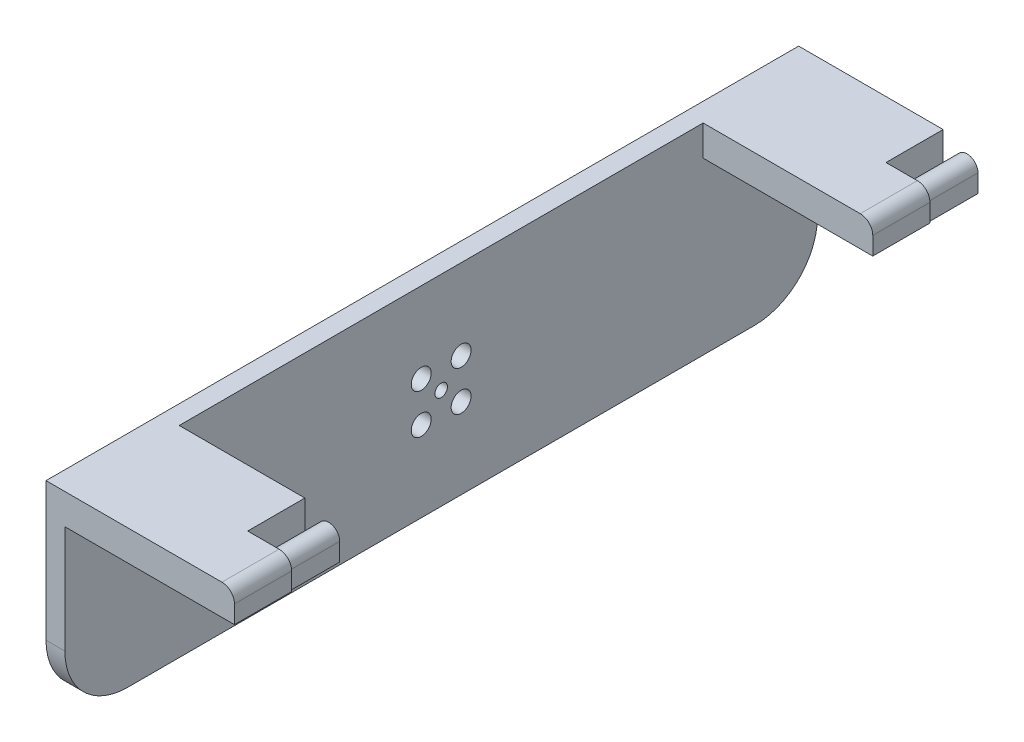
SolidWorks part; units mm, degrees
ref_plane "Front Plane" through (0, 0, 0) normal (0, 0, 1) x (1, 0, 0)
ref_plane "Top Plane" through (0, 0, 0) normal (0, 1, 0) x (1, 0, 0)
ref_plane "Right Plane" through (0, 0, 0) normal (1, 0, 0) x (0, 0, -1)
sketch "Sketch1" plane through (0, 0, 0) normal (0, 0, 1) x (1, 0, 0)
  line L2 (-1.75, 0) -> (-1.75, -2.85)
  line L3 (-1.75, -2.85) -> (1.75, -2.85)
  line L4 (1.75, 0) -> (1.75, -2.85)
  arc A0 (1.75, 0) -> (-1.75, 0) centre (0, 0) ccw
  dimension "D1" = 3.5
  dimension "D2" = 2.85
extrude "Extrude1" add sketch "Sketch1" along normal blind 7.9
sketch "Sketch2" plane through (0, -2.85, 0) normal (0, -1, 0) x (1, 0, 0)
  line L0 (0, 7.9) -> (0, 0) construction
  line L1 (-1.75, 7.9) -> (1.75, 7.9) construction
  circle A0 centre (0, 6.4) radius 0.5956
  dimension "D2" = 1.1913
  dimension "D1" = 1.5
extrude "Cut-Extrude1" cut sketch "Sketch2" against normal blind 3.5
sketch "Sketch3" plane through (0, 0, 7.9) normal (0, 0, 1) x (1, 0, 0)
  line L0 (0, 0) -> (0, -2.85) construction
  line L1 (2, -2.85) -> (-25, -2.85)
  line L2 (2, 0) -> (2, -2.85)
  line L3 (0, 2) -> (-25, 2)
  line L4 (-25, 2) -> (-25, -2.85)
  line L5 (-1.75, -2.85) -> (1.75, -2.85) construction
  arc A2 (2, 0) -> (0, 2) centre (0, 0) ccw
  dimension "D2" = 2
  dimension "D3" = 25
extrude "Extrude2" add sketch "Sketch3" along normal blind 9.1
sketch "Sketch4" plane through (0, 0, 7.9) normal (0, 0, -1) x (-1, 0, 0)
  line L0 (0, 2) -> (25, 2) construction
  line L1 (25, -2.85) -> (5, -2.85)
  line L2 (25, -2.85) -> (25, 2)
  line L3 (25, 2) -> (5, 2)
  line L4 (5, -2.85) -> (5, 2)
  dimension "D1" = 5
extrude "Extrude3" add sketch "Sketch4" along normal blind 9.1
sketch "Sketch9" plane through (0, 2, 0) normal (0, 1, 0) x (-1, 0, 0)
  line L0 (0, 7.9) -> (22, 7.9) construction
  circle A0 centre (22, 7.9) radius 2.5
  dimension "D2" = 5
  dimension "D1" = 22
extrude "Cut-Extrude4" cut sketch "Sketch9" against normal through all
sketch "Sketch5" plane through (-25, 0, 0) normal (-1, 0, 0) x (0, 0, 1)
  line L0 (7.9, 2) -> (7.9, -2.85) construction
  line L1 (7.9, -0.425) -> (7.9, -13.425) construction
  line L2 (17, 2) -> (-1.2, 2) construction
  line L3 (-102.8, 2) -> (17, 2)
  line L4 (-102.8, 2) -> (-102.8, -30)
  line L5 (-102.8, -30) -> (17, -30)
  line L6 (17, 2) -> (17, -30)
  line L8 (17, 2) -> (17, -2.85) construction
  line L9 (-42.9, 2) -> (-42.9, -30) construction
  circle A0 centre (-42.9, -14) radius 1
  point P0 (7.9, -0.425)
  dimension "D3" = 2
  dimension "D1" = 13
  dimension "D2" = 50.8
  dimension "D4" = 32
extrude "WIDE_BASE" add sketch "Sketch5" along normal blind 3
pattern_linear "LPattern1" count 2 spacing 101.6 along (0, 0, -1) of "Extrude2", "Extrude3", "Cut-Extrude4"
sketch "Sketch6" plane through (0, 0, -93.7) normal (0, 0, -1) x (-1, 0, 0)
  line L0 (-1.75, -2.85) -> (1.75, -2.85)
  line L1 (1.75, -2.85) -> (1.75, 0)
  line L2 (-1.75, 0) -> (-1.75, -2.85)
  arc A0 (1.75, 0) -> (-1.75, 0) centre (0, 0) ccw
extrude "Extrude5" add sketch "Sketch6" along normal blind 7.9
sketch "Sketch7" plane through (0, -2.85, 0) normal (0, -1, 0) x (1, 0, 0)
  line L0 (0, -101.6) -> (0, -93.7) construction
  line L1 (1.75, -101.6) -> (-1.75, -101.6) construction
  line L2 (-5, -93.7) -> (-1.75, -93.7) construction
  circle A0 centre (0, -95.2) radius 0.5956
  circle A1 centre (0, 6.4) radius 0.5956 construction
  dimension "D1" = 1.5
extrude "Cut-Extrude2" cut sketch "Sketch7" against normal blind 3
fillet "Fillet1" radius 10 2 edges at (-26.5, -30, -102.8) (-26.5, -30, 17)
sketch "Sketch8" plane through (0, -2.85, 0) normal (0, -1, 0) x (1, 0, 0)
  line L0 (-28, -92.8) -> (-28, 7) construction
  line L1 (2, -1.2) -> (-28, -1.2)
  line L2 (2, -1.2) -> (2, -102.8)
  line L3 (2, -102.8) -> (-28, -102.8)
  line L4 (-28, -1.2) -> (-28, -102.8)
  line L5 (-5, -1.2) -> (-25, -1.2) construction
  line L6 (-5, -102.8) -> (-25, -102.8) construction
  line L7 (2, 17) -> (2, 7.9) construction
extrude "Cut-Extrude3" cut sketch "Sketch8" against normal through all and the other way through all
sketch "Sketch10" plane through (-25, 0, 0) normal (1, 0, 0) x (0, 0, -1)
  line L0 (42.9, -14) -> (42.9, 9.859) construction
  line L1 (42.9, -14) -> (60.3303, -14) construction
  circle A0 centre (46.075, -10.825) radius 1.5875
  circle A1 centre (39.725, -10.825) radius 1.5875
  circle A2 centre (39.725, -17.175) radius 1.5875
  circle A3 centre (46.075, -17.175) radius 1.5875
  dimension "D2" = 3.175
  dimension "D3" = 6.35
  dimension "D1" = 6.35
extrude "2small-top-holes" cut sketch "Sketch10" against normal through all
